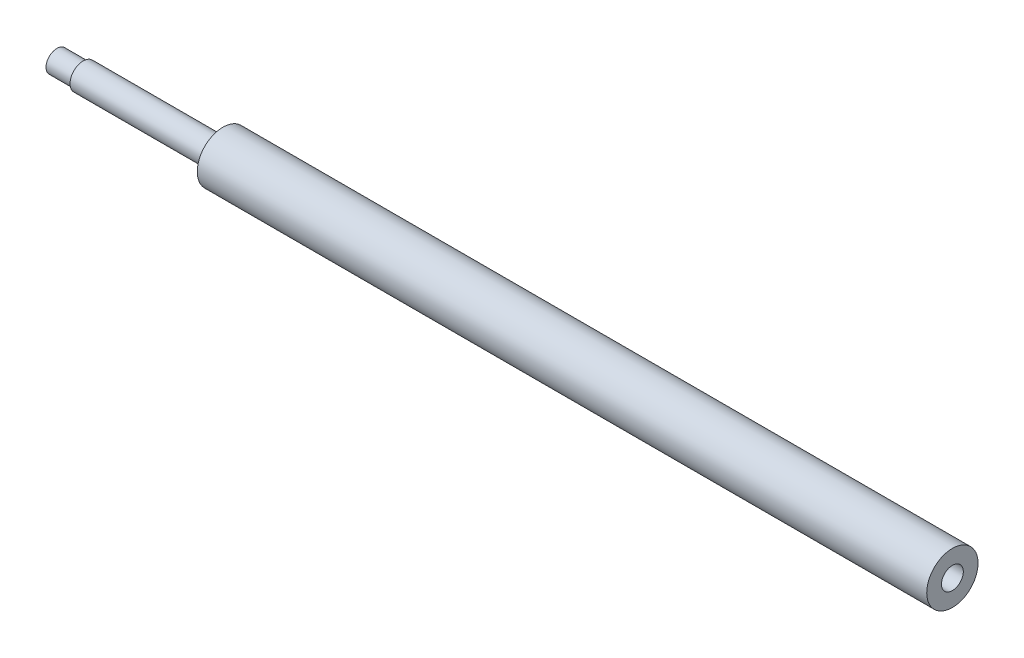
SolidWorks part; units mm, degrees
ref_plane "Plan1" through (0, 0, 0) normal (0, 0, 1) x (1, 0, 0)
ref_plane "Plan2" through (0, 0, 0) normal (0, 1, 0) x (1, 0, 0)
ref_plane "Plan3" through (0, 0, 0) normal (1, 0, 0) x (0, 0, -1)
sketch "Esquisse1" plane through (0, 0, 0) normal (0, 0, 1) x (1, 0, 0)
  line L0 (0, 0) -> (140, 0) construction
  line L1 (0, 0) -> (0, 2.5)
  line L2 (0, 2.5) -> (6, 2.5)
  line L3 (6, 2.5) -> (6, 3)
  line L4 (6, 3) -> (38, 3)
  line L7 (38, 3) -> (38, 5.875)
  line L8 (38, 5.875) -> (205, 5.875)
  line L9 (205, 5.875) -> (205, 0)
  line L10 (205, 0) -> (0, 0)
  dimension "D1" = 2.5
  dimension "D2" = 3
  dimension "D3" = 6
  dimension "D4" = 32
  dimension "D5" = 5.875
  dimension "D6" = 167
revolve "Base-Révolution" add sketch "Esquisse1" angle 360 about L0
ref_plane "Plan4" through (209, 0, 0) normal (1, 0, 0) x (0, 0, -1)
sketch "Esquisse6" plane through (209, 0, 0) normal (1, 0, 0) x (0, 0, -1)
  circle A0 centre (0, 0) radius 6
  circle A1 centre (0, 0) radius 5.875 construction
  dimension "D1" = 12
hole_wizard "Perçage1" positions "Esquisse8" profile "Esquisse7" hole size "M6" standard "ISO"
sketch "Esquisse8" plane through (205, 0, 0) normal (1, 0, 0) x (0, 0, -1)
  point P0 (0, 0)
sketch "Esquisse7" plane through (205, 0, 0) normal (0, 1, 0) x (0, 0, -1)
  line L0 (0, 0) -> (0, 21.5022)
  line L1 (0, 21.5022) -> (2.5, 20)
  line L2 (2.5, 20) -> (2.5, 0)
  line L5 (2.5, 0) -> (0, 0)
  line L10 (0, 21.5022) -> (-2.5, 20) construction
  line L11 (0, -6.35) -> (0, 107.95) construction
  dimension "Diamètre du perçage" = 5
  dimension "Profondeur du perçage" = 20
  dimension "Angle de pointe" = 118
sketch "Esquisse9" plane through (0, 0, 0) normal (0, 1, 0) x (1, 0, 0)
  point P0 (171.7942, 0)
sketch "Esq_WRNL_Compact001" plane through (0, 0, 0) normal (0, 0, 1) x (1, 0, 0)
  line L0 (-1, -6.875) -> (-1, 6.875)
  line L1 (206, -6.875) -> (206, 6.875)
  line L2 (-1, -6.875) -> (206, -6.875)
  line L3 (-1, 6.875) -> (206, 6.875)
